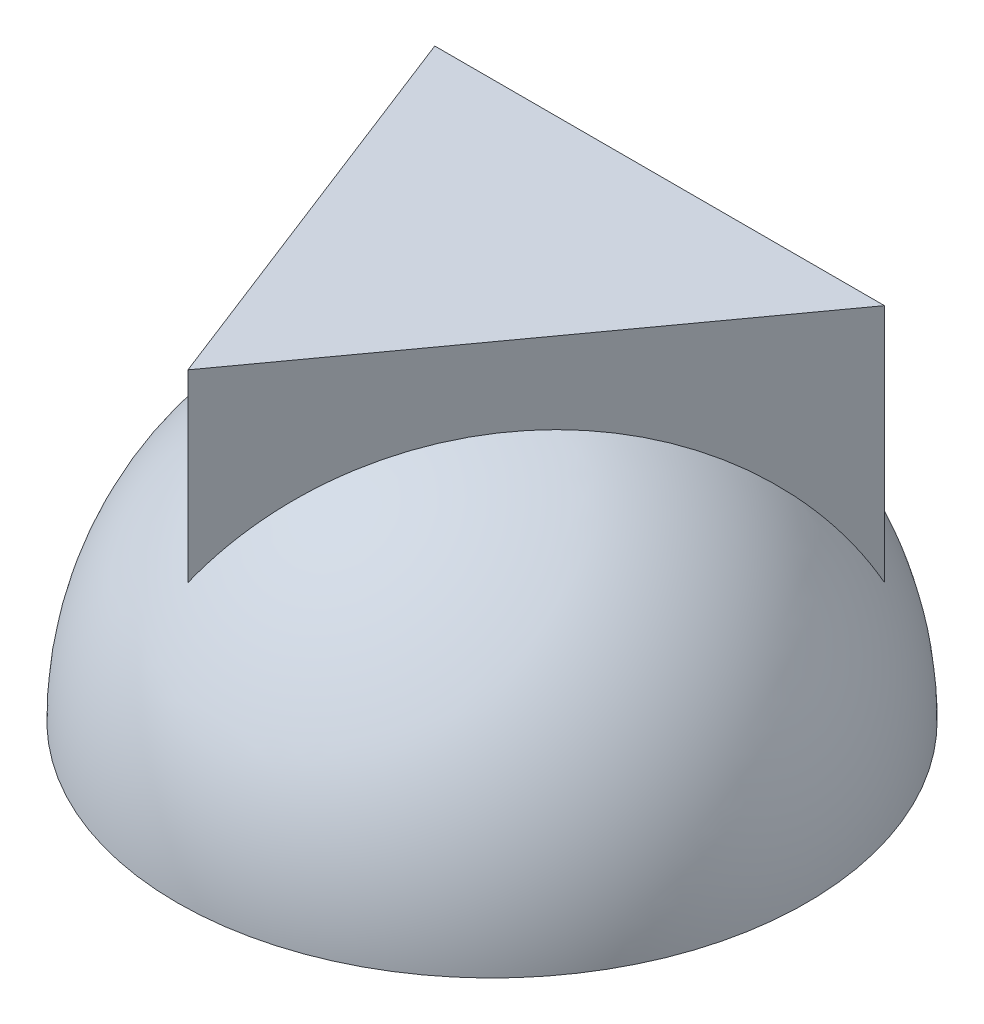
SolidWorks part; units mm, degrees
ref_plane "前视基准面" through (0, 0, 0) normal (0, 0, 1) x (1, 0, 0)
ref_plane "上视基准面" through (0, 0, 0) normal (0, 1, 0) x (1, 0, 0)
ref_plane "右视基准面" through (0, 0, 0) normal (1, 0, 0) x (0, 0, -1)
sketch "草图1" plane through (0, 0, 0) normal (0, 1, 0) x (1, 0, 0)
  line L0 (0, 38.5) -> (0, -38.5)
  arc A0 (0, -38.5) -> (0, 38.5) centre (0, 0) ccw
  dimension "D1" = 77
revolve "旋转1" add sketch "草图1" angle 180 about L0
sketch "草图2" plane through (0, 0, 0) normal (0, 1, 0) x (1, 0, 0)
  line L0 (-28, 21) -> (-8.7909, -28.3965)
  line L1 (-8.7909, -28.3965) -> (27, 21)
  line L2 (27, 21) -> (-28, 21)
  dimension "D1" = 55
  dimension "D2" = 61
  dimension "D3" = 53
  dimension "D4" = 21
  dimension "D5" = 28
extrude "凸台-拉伸1" add sketch "草图2" along normal blind 47
